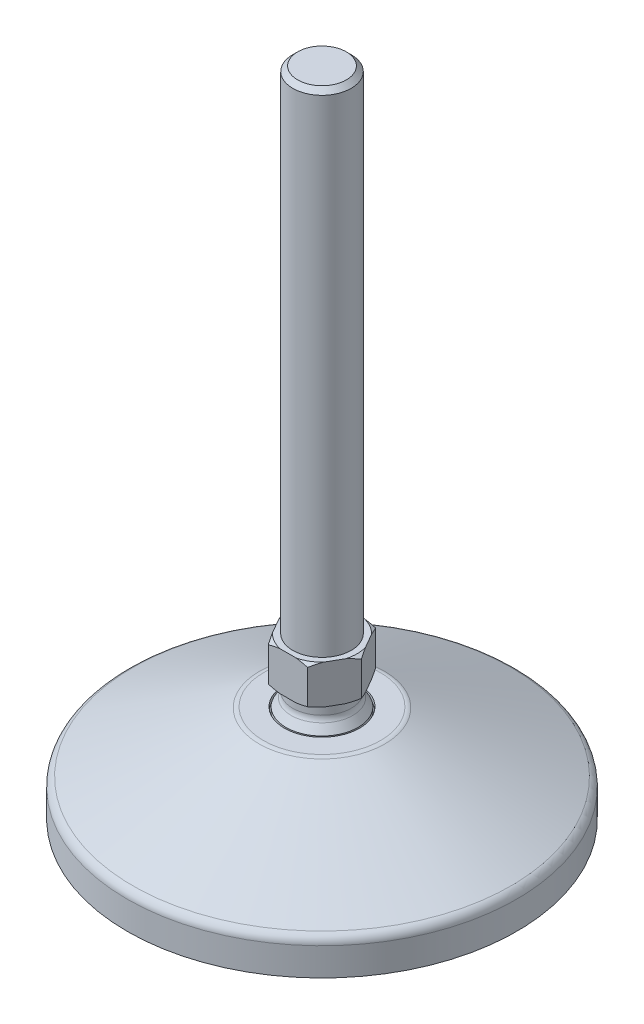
SolidWorks part; units mm, degrees
ref_plane "Front Plane" through (0, 0, 0) normal (0, 0, 1) x (1, 0, 0)
ref_plane "Top Plane" through (0, 0, 0) normal (0, 1, 0) x (1, 0, 0)
ref_plane "Right Plane" through (0, 0, 0) normal (1, 0, 0) x (0, 0, -1)
sketch "Sketch1" plane through (0, 0, 0) normal (0, 1, 0) x (1, 0, 0)
  circle A1 centre (0, 0) radius 35
  dimension "D1" = 70
extrude "Boss-Extrude1" add sketch "Sketch1" along normal blind 2
sketch "Sketch2" plane through (0, 2, 0) normal (0, 1, 0) x (1, 0, 0)
  circle A0 centre (0, 0) radius 40
  dimension "D1" = 80
extrude "Boss-Extrude2" add sketch "Sketch2" along normal blind 7
ref_plane "Plane1" through (0, 22, 0) normal (0, 1, 0) x (1, 0, 0)
sketch "Sketch3" plane through (0, 22, 0) normal (0, 1, 0) x (1, 0, 0)
  circle A0 centre (0, 0) radius 12.5
  dimension "D1" = 25
loft "Loft1" add profiles "Sketch3"
ref_plane "Plane2" through (0, 24.1, 0) normal (0, 1, 0) x (1, 0, 0)
sketch "Sketch4" plane through (0, 22, 0) normal (0, 1, 0) x (1, 0, 0)
  circle A0 centre (0, 0) radius 7.4
  dimension "D1" = 14.8
sketch "Sketch5" plane through (0, 24.1, 0) normal (0, 1, 0) x (1, 0, 0)
  circle A0 centre (0, 0) radius 6
  dimension "D1" = 12
loft "Loft2" add profiles "Sketch4", "Sketch5"
sketch "Sketch11" plane through (0, 22, 0) normal (0, 1, 0) x (1, 0, 0)
  circle A0 centre (0, 0) radius 7.4 construction
  circle A1 centre (0, 0) radius 7.4
  circle A2 centre (0, 0) radius 7.7
  dimension "D1" = 0.3
extrude "Cut-Extrude1" cut sketch "Sketch11" against normal blind 1
sketch "Sketch6" plane through (0, 24.1, 0) normal (0, 1, 0) x (1, 0, 0)
  circle A1 centre (0, 0) radius 6
  circle A2 centre (0, 0) radius 6
  dimension "D1" = 0
extrude "Boss-Extrude3" add sketch "Sketch6" along normal blind 2.9
sketch "Sketch7" plane through (0, 27, 0) normal (0, 1, 0) x (1, 0, 0)
  circle A0 centre (0, 0) radius 6
  dimension "D1" = 12
extrude "Boss-Extrude4" add sketch "Sketch7" along normal blind 109
ref_plane "Plane3" through (0, 27, 0) normal (0, 1, 0) x (1, 0, 0)
sketch "Sketch8" plane through (0, 27, 0) normal (0, 1, 0) x (1, 0, 0)
  line L1 (8.0829, 0) -> (4.0415, 7)
  line L2 (4.0415, 7) -> (-4.0415, 7)
  line L3 (-4.0415, 7) -> (-8.0829, 0)
  line L4 (-8.0829, 0) -> (-4.0415, -7)
  line L5 (-4.0415, -7) -> (4.0415, -7)
  line L6 (4.0415, -7) -> (8.0829, 0)
  circle A0 centre (0, 0) radius 7 construction
  circle A1 centre (0, 0) radius 6 construction
  circle A2 centre (0, 0) radius 6
  dimension "D1" = 14
extrude "Boss-Extrude5" add sketch "Sketch8" along normal blind 8
sketch "Sketch9" plane through (0, 0, 0) normal (0, 0, 1) x (1, 0, 0)
  line L0 (-7.2, 35) -> (-8.0829, 34.5)
  line L1 (-8.0829, 35) -> (-4.0415, 35) construction
  line L2 (-8.0829, 35) -> (-8.0829, 27) construction
  line L3 (-8.0829, 27.5) -> (-7.2, 27)
  line L4 (-8.0829, 27) -> (-4.0415, 27) construction
  line L5 (-7.2, 35) -> (-7.2, 27) construction
  line L6 (0, -44) -> (0, 44) construction
  line L7 (-8.0829, 27.5) -> (-8.0829, 27)
  line L8 (-8.0829, 27) -> (-7.2, 27)
  line L9 (-7.2, 35) -> (-8.0829, 35)
  line L10 (-8.0829, 35) -> (-8.0829, 34.5)
  dimension "D1" = 7.2
  dimension "D2" = 0.5
  dimension "D3" = 0.5
revolve "Cut-Revolve1" cut sketch "Sketch9" angle 360 about axis through (0, 27, 0) along (0, -1, 0)
chamfer "Chamfer1" distance 1 angle 45 1 edges at (0, 136, 6)
sketch "Sketch10" plane through (0, 0, 0) normal (0, -1, 0) x (1, 0, 0)
  line L0 (3, 6) -> (30.9233, 6)
  line L2 (-3, -31.3568) -> (-3, -6)
  line L4 (3, -31.3568) -> (3, -6)
  line L5 (-3, -31.3568) -> (3, 31.3568) construction
  line L6 (-3, 31.3568) -> (3, -31.3568) construction
  line L7 (-30.9233, -6) -> (-3, -6)
  line L9 (-30.9233, 6) -> (-3, 6)
  line L11 (-30.9233, -6) -> (30.9233, 6) construction
  line L12 (-30.9233, 6) -> (30.9233, -6) construction
  line L13 (3, 6) -> (3, 31.3568)
  line L14 (-3, 6) -> (-3, 31.3568)
  line L15 (3, -6) -> (30.9233, -6)
  arc A0 (-30.9233, -6) -> (-3, -31.3568) centre (0, 0) ccw
  arc A1 (30.9233, 6) -> (3, 31.3568) centre (0, 0) ccw
  arc A2 (-3, 31.3568) -> (-30.9233, 6) centre (0, 0) ccw
  arc A3 (3, -31.3568) -> (30.9233, -6) centre (0, 0) ccw
  dimension "D1" = 63
  dimension "D2" = 6
  dimension "D3" = 12
extrude "Boss-Extrude6" add sketch "Sketch10" along normal blind 1
fillet "Fillet1" radius 2 2 edges at (0, 9, 40) (0, 22, 12.5)
fillet "Fillet2" radius 2 1 edges at (0, 24.1, 6)
fillet "Fillet3" radius 1 12 edges at (3, -0.5, -31.3568) (3, -0.5, -6) (30.9233, -0.5, -6) (30.9233, -0.5, 6) (3, -0.5, 31.3568) (3, -0.5, 6) (-3, -0.5, 31.3568) (-3, -0.5, 6) (-30.9233, -0.5, 6) (-30.9233, -0.5, -6) (-3, -0.5, -31.3568) (-3, -0.5, -6)
